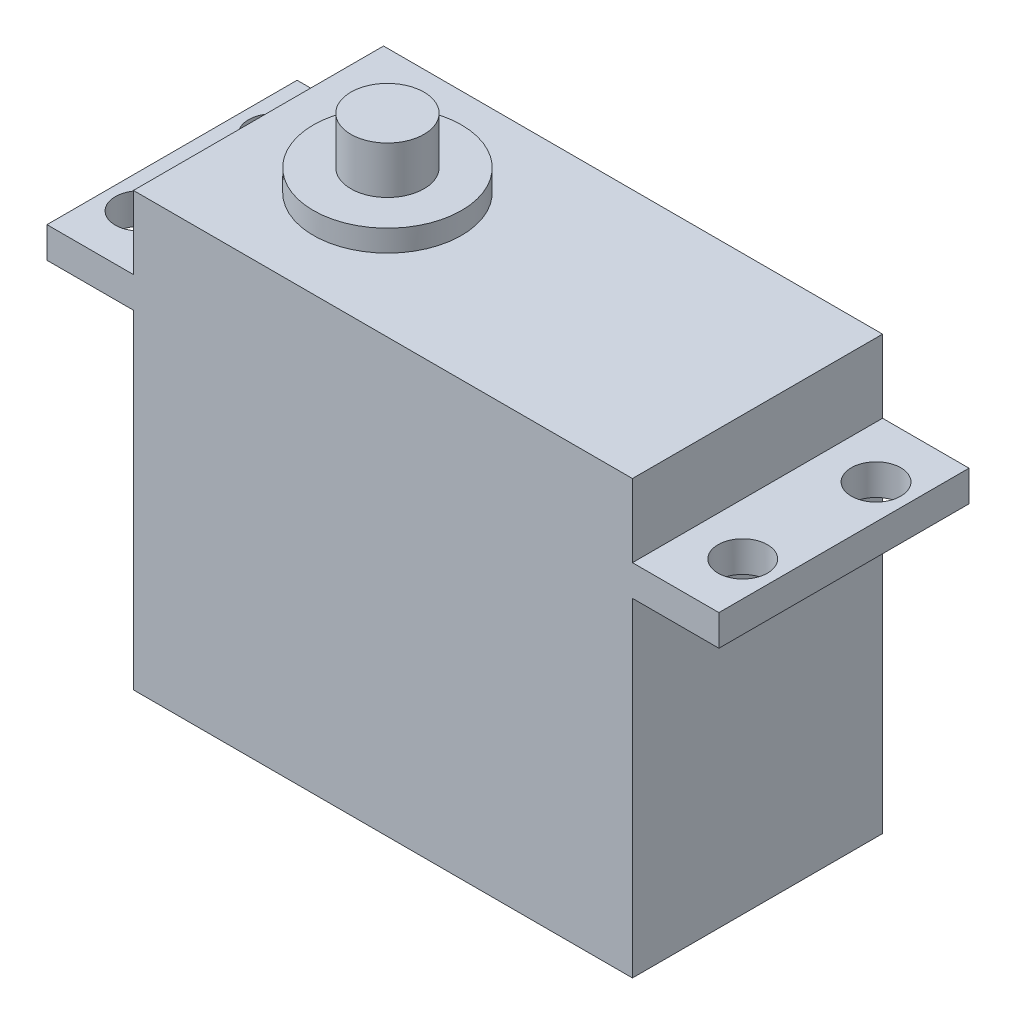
SolidWorks part; units mm, degrees
ref_plane "Front Plane" through (0, 0, 0) normal (0, 0, 1) x (1, 0, 0)
ref_plane "Top Plane" through (0, 0, 0) normal (0, 1, 0) x (1, 0, 0)
ref_plane "Right Plane" through (0, 0, 0) normal (1, 0, 0) x (0, 0, -1)
sketch "Sketch1" plane through (0, 0, 0) normal (0, 1, 0) x (1, 0, 0)
  line L0 (0, 0) -> (40.4, 0)
  line L1 (40.4, 0) -> (40.4, 20.25)
  line L2 (40.4, 20.25) -> (0, 20.25)
  line L3 (0, 20.25) -> (0, 0)
extrude "Boss-Extrude1" add sketch "Sketch1" along normal blind 26.62
sketch "Sketch2" plane through (0, 26.62, 0) normal (0, 1, 0) x (-1, 0, 0)
  line L0 (-20.2, 0) -> (-47.4, 0)
  line L1 (0, 0) -> (-40.4, 0) construction
  line L2 (-47.4, 0) -> (-47.4, -20.25)
  line L3 (-47.4, -20.25) -> (7, -20.25)
  line L4 (7, -20.25) -> (7, 0)
  line L5 (7, 0) -> (-20.2, 0)
extrude "Boss-Extrude2" add sketch "Sketch2" along normal blind 2.5
sketch "Sketch3" plane through (0, 29.12, 0) normal (0, 1, 0) x (-1, 0, 0)
  line L0 (0, 0) -> (0, -20.25)
  line L1 (-47.4, -20.25) -> (7, -20.25) construction
  line L2 (0, -20.25) -> (-40.4, -20.25)
  line L3 (-40.4, -20.25) -> (-40.4, 0)
  line L4 (7, 0) -> (-47.4, 0) construction
  line L5 (-40.4, 0) -> (0, 0)
extrude "Boss-Extrude3" add sketch "Sketch3" along normal blind 5.9
sketch "Sketch4" plane through (0, 35.02, 0) normal (0, 1, 0) x (-1, 0, 0)
  line L0 (0, -10.125) -> (-7.48, -10.125) construction
  line L1 (0, -20.25) -> (0, 0) construction
  line L2 (-7.48, -10.125) -> (-10.44, -10.125) construction
  circle A0 centre (-10.44, -10.125) radius 2.96
extrude "Boss-Extrude4" add sketch "Sketch4" along normal blind 5.57
sketch "Sketch5" plane through (0, 0, 0) normal (-1, 0, 0) x (0, 0, 1)
  line L0 (-10.125, 0) -> (-10.125, 3.35) construction
  line L1 (-20.25, 0) -> (0, 0) construction
  line L2 (-10.125, 3.35) -> (-6.88, 3.35)
  line L3 (-6.88, 3.35) -> (-6.88, 6.96)
  line L4 (-6.88, 6.96) -> (-13.37, 6.96)
  line L5 (-13.37, 6.96) -> (-13.37, 3.35)
  line L6 (-13.37, 3.35) -> (-10.125, 3.35)
extrude "Boss-Extrude5" add sketch "Sketch5" along normal blind 6.51
sketch "Sketch6" plane through (0, 29.12, 0) normal (0, 1, 0) x (-1, 0, 0)
  line L0 (7, -10.125) -> (2.2, -10.125) construction
  line L2 (7, -4.73) -> (4.2, -4.73) construction
  line L3 (7, -20.25) -> (7, 0) construction
  line L4 (-20.2, -20.25) -> (-20.2, 0) construction
  line L5 (-40.4, -20.25) -> (0, -20.25) construction
  line L6 (0, 0) -> (-40.4, 0) construction
  circle A0 centre (4.2, -4.73) radius 2
  circle A1 centre (4.2, -15.52) radius 2
  circle A2 centre (-44.6, -15.52) radius 2
  circle A3 centre (-44.6, -4.73) radius 2
extrude "Cut-Extrude1" cut sketch "Sketch6" against normal blind 6.51
sketch "Sketch7" plane through (0, 35.02, 0) normal (0, 1, 0) x (-1, 0, 0)
  circle A0 centre (-10.44, -10.125) radius 6
extrude "Boss-Extrude6" add sketch "Sketch7" along normal blind 1.75
